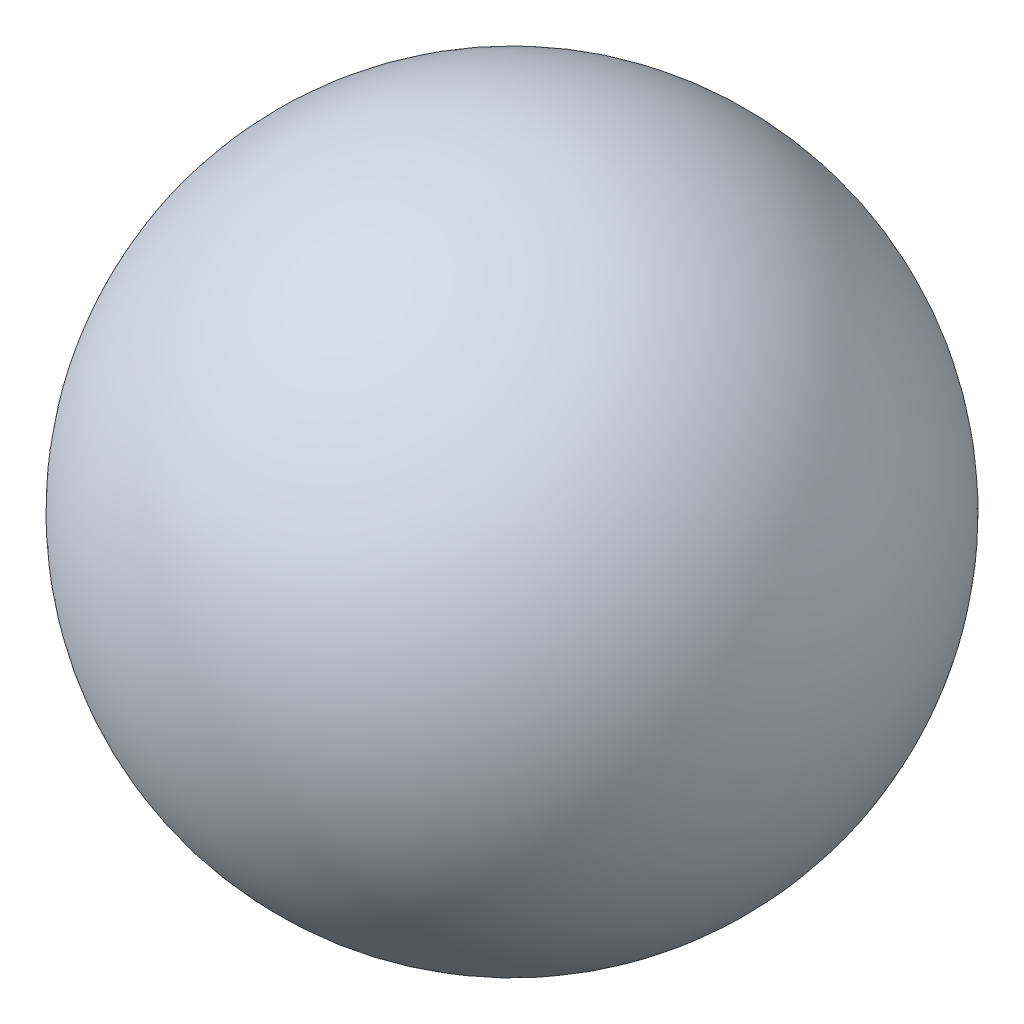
SolidWorks part; units mm, degrees
ref_plane "Plan1" through (0, 0, 0) normal (0, 0, 1) x (1, 0, 0)
ref_plane "Plan2" through (0, 0, 0) normal (0, 1, 0) x (1, 0, 0)
ref_plane "Plan3" through (0, 0, 0) normal (1, 0, 0) x (0, 0, -1)
sketch "Esquisse1" plane through (0, 0, 0) normal (0, 1, 0) x (1, 0, 0)
  line L1 (-0.3, 3.7) -> (7.7, 3.7) construction
  line L2 (-0.3, 7.4) -> (-0.3, 0) construction
  line L3 (7.7, 7.4) -> (7.7, 0) construction
  line L4 (1.3, 3.7) -> (6.1, 3.7)
  circle A1 centre (3.7, 3.7) radius 2.4 construction
  arc A2 (6.1, 3.7) -> (1.3, 3.7) centre (3.7, 3.7) ccw
revolve "Base-Révolution" add sketch "Esquisse1" angle 360 about L1
